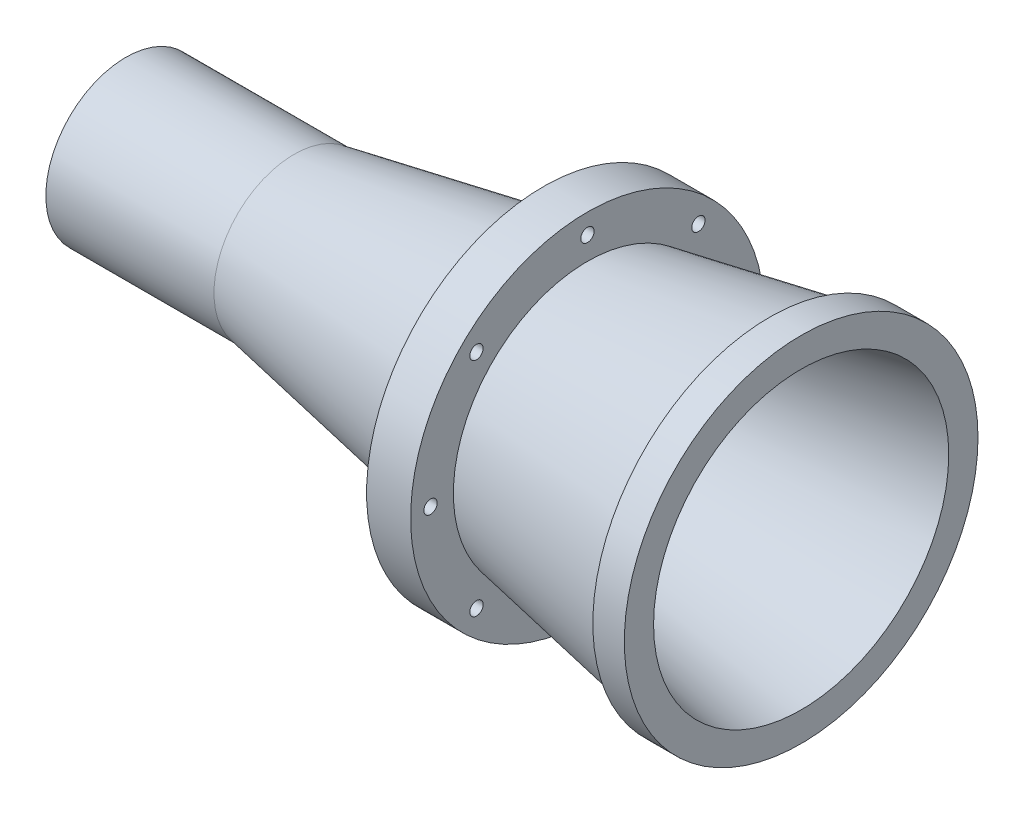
SolidWorks part; units mm, degrees
ref_plane "Front Plane" through (0, 0, 0) normal (0, 0, 1) x (1, 0, 0)
ref_plane "Top Plane" through (0, 0, 0) normal (0, 1, 0) x (1, 0, 0)
ref_plane "Right Plane" through (0, 0, 0) normal (1, 0, 0) x (0, 0, -1)
sketch "Sketch2" plane through (0, 0, 0) normal (0, 0, 1) x (1, 0, 0)
  line L0 (217.0957, 92.6398) -> (217.0957, 8.4896) construction
  line L1 (-104.2143, 46.5896) -> (-24.2043, 46.5896)
  line L2 (202.1097, 92.6398) -> (217.0957, 92.6398)
  line L3 (217.0957, 92.6398) -> (217.0957, 78.7206)
  line L4 (217.0957, 8.4896) -> (-104.2143, 8.4896) construction
  line L6 (115.4079, 92.6398) -> (94.4529, 92.6398)
  line L7 (-104.2143, 46.5896) -> (-104.2143, 19.9196)
  line L8 (94.4529, 92.6398) -> (94.4529, 68.4336)
  line L9 (-104.2143, 19.9196) -> (217.0957, 78.7206)
  line L10 (94.4529, 68.4336) -> (-24.2043, 46.5896)
  line L12 (115.4079, 92.6398) -> (115.4079, 72.2913)
  line L13 (115.4079, 72.2913) -> (202.1097, 88.2525)
  line L14 (202.1097, 88.2525) -> (202.1097, 92.6398)
  line L15 (-104.2143, 8.4896) -> (-104.2143, 46.5896) construction
  dimension "D1" = 101.6877
  dimension "D2" = 59.944
  dimension "D3" = 84.1502
  dimension "D4" = 20.955
revolve "Revolve3" add sketch "Sketch2" angle 360 about L4
sketch "Sketch3" plane through (94.4529, 0, 0) normal (-1, 0, 0) x (0, 0, 1)
  line L0 (0, 8.4896) -> (0, 83.1656) construction
  dimension "D1" = 74.676
hole_wizard "1/4-20 Tapped Hole1" positions "Sketch5" profile "Sketch6" tap size "1/4-20" standard "ANSI Inch"
sketch "Sketch5" plane through (94.4529, 0, 0) normal (-1, 0, 0) x (0, 0, 1)
  point P0 (0, 83.1656)
sketch "Sketch6" plane through (94.4529, 83.1656, 0) normal (0, 1, 0) x (0, 0, 1)
  line L0 (0, 0) -> (0, 122.6427)
  line L1 (0, 122.6427) -> (3.175, 122.6427)
  line L2 (3.175, 122.6427) -> (3.175, 0)
  line L5 (3.175, 0) -> (0, 0)
  line L11 (0, -6.35) -> (0, 107.95) construction
  dimension "Thread Major Dia." = 6.35
  dimension "Thru Tap Drill Depth" = 122.6427
pattern_circular "CirPattern1" count 8 over 360 about axis through (0, 8.4896, 0) along (1, 0, 0) of "1/4-20 Tapped Hole1"
